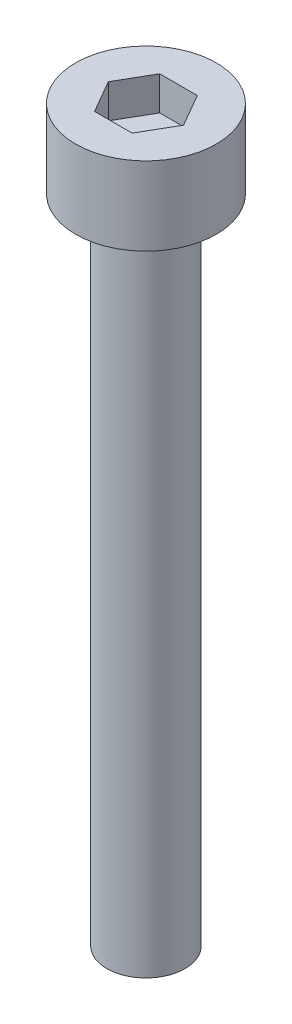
SolidWorks part; units mm, degrees
ref_plane "前视基准面" through (0, 0, 0) normal (0, 0, 1) x (1, 0, 0)
ref_plane "上视基准面" through (0, 0, 0) normal (0, 1, 0) x (1, 0, 0)
ref_plane "右视基准面" through (0, 0, 0) normal (1, 0, 0) x (0, 0, -1)
sketch "草图1" plane through (0, 0, 0) normal (0, 1, 0) x (1, 0, 0)
  circle A0 centre (0, 0) radius 1.5
  dimension "D1" = 3
extrude "凸台-拉伸1" add sketch "草图1" along normal blind 25
sketch "草图2" plane through (0, 25, 0) normal (0, 1, 0) x (1, 0, 0)
  circle A0 centre (0, 0) radius 2.7
  dimension "D1" = 5.4
extrude "凸台-拉伸2" add sketch "草图2" along normal blind 3
sketch "草图3" plane through (0, 28, 0) normal (0, 1, 0) x (1, 0, 0)
  line L1 (1.4434, 0) -> (0.7217, 1.25)
  line L2 (0.7217, 1.25) -> (-0.7217, 1.25)
  line L3 (-0.7217, 1.25) -> (-1.4434, 0)
  line L4 (-1.4434, 0) -> (-0.7217, -1.25)
  line L5 (-0.7217, -1.25) -> (0.7217, -1.25)
  line L6 (0.7217, -1.25) -> (1.4434, 0)
  circle A0 centre (0, 0) radius 1.25 construction
  dimension "D1" = 2.5
extrude "切除-拉伸1" cut sketch "草图3" against normal blind 1.3
